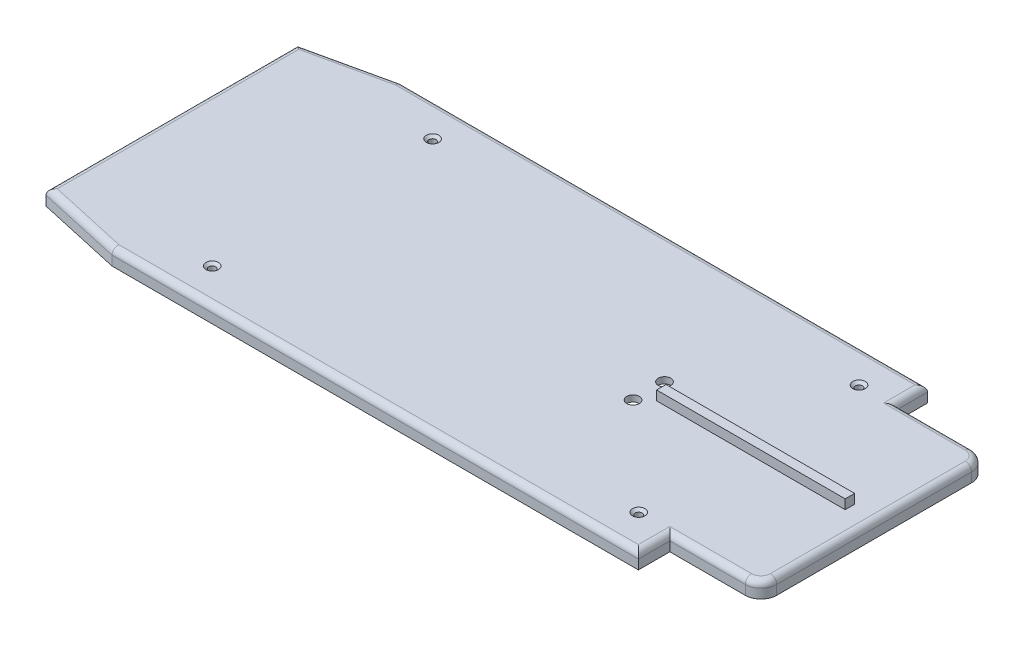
SolidWorks part; units mm, degrees
ref_plane "Front Plane" through (0, 0, 0) normal (0, 0, 1) x (1, 0, 0)
ref_plane "Top Plane" through (0, 0, 0) normal (0, 1, 0) x (1, 0, 0)
ref_plane "Right Plane" through (0, 0, 0) normal (1, 0, 0) x (0, 0, -1)
sketch "Sketch1" plane through (0, 0, 0) normal (0, 1, 0) x (1, 0, 0)
  line L0 (-95.25, 53.594) -> (95.25, -53.594) construction
  line L1 (-95.25, 53.594) -> (95.25, 53.594)
  line L2 (-95.25, 53.594) -> (-95.25, -53.594)
  line L3 (-95.25, -53.594) -> (95.25, -53.594)
  line L4 (95.25, 53.594) -> (95.25, -53.594)
  dimension "D1" = 190.5
  dimension "D2" = 107.188
extrude "Boss-Extrude1" add sketch "Sketch1" along normal blind 2.54
sketch "Sketch3" plane through (0, 0, 0) normal (0, -1, 0) x (1, 0, 0)
  line L0 (-95.25, 49.9745) -> (95.25, 49.9745) construction
  line L1 (-95.25, -53.594) -> (-95.25, 53.594) construction
  line L2 (95.25, 53.594) -> (95.25, -53.594) construction
  line L3 (-95.25, 53.594) -> (95.25, 53.594) construction
  line L4 (-91.6305, 53.594) -> (-91.6305, -53.594) construction
  line L5 (95.25, -53.594) -> (-95.25, -53.594) construction
  line L6 (-95.25, -49.9745) -> (95.25, -49.9745) construction
  line L7 (91.6305, 53.594) -> (91.6305, -53.594) construction
  circle A0 centre (-86.1695, -44.5135) radius 3.81
  circle A1 centre (-86.1695, 44.5135) radius 3.81
  circle A2 centre (86.1695, 44.5135) radius 3.81
  circle A3 centre (86.1695, -44.5135) radius 3.81
  dimension "D5" = 7.62
  dimension "D9" = 5.461
  dimension "D1" = 3.6195
  dimension "D2" = 3.6195
  dimension "D3" = 3.6195
  dimension "D4" = 3.6195
  dimension "D6" = 5.461
  dimension "D7" = 5.461
  dimension "D8" = 5.461
  dimension "D10" = 5.461
  dimension "D11" = 5.461
  dimension "D12" = 5.461
  dimension "D13" = 5.461
extrude "Boss-Extrude2" add sketch "Sketch3" along normal blind 3.81
sketch "Sketch4" plane through (0, 0, 53.594) normal (0, 0, 1) x (1, 0, 0)
  line L0 (-95.25, 0) -> (-95.25, 2.54)
  line L1 (-95.25, 2.54) -> (95.25, 2.54)
  line L2 (95.25, 2.54) -> (95.25, 0)
  line L3 (95.25, 2.54) -> (95.25, 0) construction
  line L4 (-95.25, 0) -> (95.25, 0) construction
  line L5 (95.25, 0) -> (-95.25, 0)
extrude "Boss-Extrude3" add sketch "Sketch4" along normal blind 4.826
sketch "Sketch5" plane through (0, 0, -53.594) normal (0, 0, -1) x (-1, 0, 0)
  line L0 (-95.25, 2.54) -> (-95.25, 0)
  line L1 (-95.25, 0) -> (95.25, 0)
  line L2 (95.25, 0) -> (95.25, 2.54)
  line L3 (95.25, 2.54) -> (-95.25, 2.54)
extrude "Boss-Extrude4" add sketch "Sketch5" along normal blind 4.826
sketch "Sketch6" plane through (95.25, 0, 0) normal (1, 0, 0) x (0, 0, -1)
  line L0 (-58.42, 2.54) -> (-58.42, 0)
  line L1 (-58.42, 0) -> (58.42, 0)
  line L2 (58.42, 0) -> (58.42, 2.54)
  line L3 (58.42, 2.54) -> (-58.42, 2.54)
extrude "Boss-Extrude5" add sketch "Sketch6" along normal blind 4.699
sketch "Sketch7" plane through (99.949, 0, 0) normal (1, 0, 0) x (0, 0, -1)
  line L0 (-45.72, 2.54) -> (-45.72, 0)
  line L1 (58.42, 2.54) -> (-58.42, 2.54) construction
  line L2 (-58.42, 0) -> (58.42, 0) construction
  line L3 (-45.72, 0) -> (45.72, 0)
  line L4 (45.72, 0) -> (45.72, 2.54)
  line L5 (45.72, 2.54) -> (-45.72, 2.54)
  line L6 (-58.42, 2.54) -> (-58.42, 0) construction
  line L7 (58.42, 0) -> (58.42, 2.54) construction
  dimension "D1" = 12.7
  dimension "D2" = 12.7
extrude "Boss-Extrude6" add sketch "Sketch7" along normal blind 36.83
sketch "Sketch8" plane through (0, 2.54, 0) normal (0, 1, 0) x (1, 0, 0)
  line L0 (-95.25, 58.42) -> (-112.776, 58.42)
  line L1 (-95.25, -58.42) -> (-112.776, -58.42)
  line L2 (-112.776, -58.42) -> (-147.066, -50.8)
  line L3 (-95.25, 58.42) -> (-95.25, -58.42)
  line L4 (-147.066, -50.8) -> (-147.066, 50.8)
  line L5 (-112.776, 58.42) -> (-147.066, 50.8)
  dimension "D1" = 7.62
  dimension "D2" = 7.62
  dimension "D3" = 34.29
  dimension "D4" = 34.29
  dimension "D5" = 17.526
extrude "Boss-Extrude7" add sketch "Sketch8" against normal blind 2.54
fillet "Fillet1" radius 6.35 2 edges at (136.779, 1.27, -45.72) (136.779, 1.27, 45.72)
sketch "Sketch9" plane through (0, -3.81, 0) normal (0, -1, 0) x (-1, 0, 0)
  circle A0 centre (-86.1695, -44.5135) radius 0.7
  circle A1 centre (-86.1695, 44.5135) radius 0.5848
  circle A2 centre (86.1695, 44.5135) radius 0.7489
  circle A3 centre (86.1695, -44.5135) radius 0.4954
extrude "Cut-Extrude1" cut sketch "Sketch9" against normal blind 17.78
hole_wizard "CSK for #3 Flat Head Machine Screw (100)1" positions "Sketch12" profile "Sketch10" countersink size "#3" standard "ANSI Inch"
sketch "Sketch12" plane through (0, 2.54, 0) normal (0, 1, 0) x (1, 0, 0)
  point P0 (86.1695, 44.5135)
  point P3 (86.1695, -44.5135)
  point P6 (-86.1695, 44.5135)
  point P9 (-86.1695, -44.5135)
sketch "Sketch10" plane through (86.1695, 2.54, -44.5135) normal (1, 0, 0) x (0, 0, 1)
  line L0 (0, 0) -> (0, 6.35)
  line L1 (0, 6.35) -> (1.397, 6.35)
  line L2 (1.397, 6.35) -> (1.397, 0.9484)
  line L3 (1.397, 0.9484) -> (2.5273, 0)
  line L5 (2.5273, 0) -> (0, 0)
  line L6 (-1.397, 0.9484) -> (-2.5273, 0) construction
  line L11 (0, -6.35) -> (0, 107.95) construction
  dimension "Thru Hole Dia." = 2.794
  dimension "Thru Hole Depth" = 6.35
  dimension "Near C'Sink Dia." = 5.0546
  dimension "Near C'Sink Angle" = 100
ref_plane "Plane1" through (-25.4, 0, 0) normal (1, 0, 0) x (0, 0, -1)
sketch "Sketch15" plane through (-25.4, 0, 0) normal (1, 0, 0) x (0, 0, -1)
  line L0 (0, 0) -> (0, 97.79) construction
  circle A0 centre (0, 97.79) radius 95.25
  circle A1 centre (0, 97.79) radius 97.79
  dimension "D2" = 190.5
  dimension "D1" = 97.79
extrude "Boss-Extrude8" add sketch "Sketch15" along normal blind 19.05
ref_plane "Plane2" through (127, 0, 0) normal (1, 0, 0) x (0, 0, -1)
sketch "Sketch16" plane through (127, 0, 0) normal (1, 0, 0) x (0, 0, -1)
  line L0 (0, 0) -> (0, 97.79) construction
  dimension "D1" = 97.79
sketch "Sketch21" plane through (-6.35, 0, 0) normal (1, 0, 0) x (0, 0, -1)
  circle A0 centre (0, 97.79) radius 97.79
sketch "Sketch22" plane through (127, 0, 0) normal (1, 0, 0) x (0, 0, -1)
  circle A0 centre (0, 97.79) radius 32.5967
loft "Loft1" add profiles "Sketch22", "Sketch21"
sketch "Sketch23" plane through (127, 0, 0) normal (1, 0, 0) x (0, 0, -1)
  circle A0 centre (0, 97.79) radius 31.75
sketch "Sketch24" plane through (-6.35, 0, 0) normal (-1, 0, 0) x (0, 0, 1)
  circle A0 centre (0, 97.79) radius 95.25
loft "Cut-Loft1" cut profiles "Sketch24", "Sketch23"
sketch "Sketch25" plane through (127, 0, 0) normal (1, 0, 0) x (0, 0, -1)
  line L0 (0, 65.1933) -> (0, 0)
  circle A0 centre (0, 97.79) radius 32.5967 construction
rib "Rib1" sketch "Sketch25" sketch "Sketch25" thickness 12.7 extrusion direction normal to sketch draft on no parameters "D1"=12.7
ref_plane "Plane3" through (12.7, 0, 0) normal (1, 0, 0) x (0, 0, -1)
sketch "Sketch26" plane through (12.7, 0, 0) normal (1, 0, 0) x (0, 0, -1)
  line L0 (0, 97.79) -> (0, 0) construction
  circle A1 centre (0, 97.79) radius 19.685
ref_plane "Plane4" through (45.72, 0, 0) normal (1, 0, 0) x (0, 0, -1)
sketch "Sketch27" plane through (45.72, 0, 0) normal (1, 0, 0) x (0, 0, -1)
  line L0 (0, 0) -> (0, 97.79) construction
  circle A0 centre (0, 97.79) radius 19.685
  dimension "D1" = 97.79
loft "Loft2" add profiles "Sketch26", "Sketch27"
sketch "Sketch28" plane through (12.7, 0, 0) normal (-1, 0, 0) x (0, 0, 1)
  circle A0 centre (0, 97.79) radius 18.415
extrude "Cut-Extrude2" cut sketch "Sketch28" against normal through all
sketch "Sketch29" plane through (45.72, 0, 0) normal (1, 0, 0) x (0, 0, -1)
  circle A0 centre (0, 97.79) radius 19.685
extrude "Boss-Extrude10" add sketch "Sketch29" along normal blind 2.54
sketch "Sketch30" plane through (48.26, 0, 0) normal (1, 0, 0) x (0, 0, -1)
  circle A0 centre (0, 97.79) radius 5.08
extrude "Cut-Extrude3" cut sketch "Sketch30" against normal blind 2.54
sketch "Sketch31" plane through (48.26, 0, 0) normal (1, 0, 0) x (0, 0, -1)
  line L0 (0, 102.87) -> (-19.0182, 102.87)
  line L1 (0, 102.87) -> (19.0182, 102.87)
  line L2 (0, 92.71) -> (19.0182, 92.71)
  line L3 (0, 0) -> (0, 97.79) construction
  line L4 (0, 92.71) -> (-19.0182, 92.71)
  circle A0 centre (0, 97.79) radius 5.08 construction
  circle A1 centre (0, 97.79) radius 19.685 construction
  arc A2 (-19.0182, 102.87) -> (-19.0182, 92.71) centre (0, 97.79) ccw
  arc A3 (19.0182, 102.87) -> (19.0182, 92.71) centre (0, 97.79) cw
extrude "Cut-Extrude4" cut sketch "Sketch31" against normal blind 2.54
sketch "Sketch33" plane through (12.7, 0, 0) normal (-1, 0, 0) x (0, 0, 1)
  line L0 (0, 97.79) -> (0, 0) construction
  line L1 (0, 85.2478) -> (-2.54, 85.2478)
  line L2 (-2.54, 85.2478) -> (-2.54, 0)
  line L3 (-2.54, 0) -> (2.54, 0)
  line L4 (2.54, 0) -> (2.54, 85.2478)
  line L5 (2.54, 85.2478) -> (0, 85.2478)
  dimension "D1" = 2.54
  dimension "D2" = 2.54
extrude "Boss-Extrude11" add sketch "Sketch33" against normal blind 35.56
sketch "Sketch34" plane through (12.7, 0, 0) normal (-1, 0, 0) x (0, 0, 1)
  circle A0 centre (0, 97.79) radius 18.415
extrude "Cut-Extrude5" cut sketch "Sketch34" against normal blind 33.02
sketch "Sketch35" plane through (45.72, 0, 0) normal (1, 0, 0) x (0, 0, -1)
  line L0 (0, 97.79) -> (104.143, 97.79) construction
  line L1 (0, 97.79) -> (-120.52, 97.79) construction
pattern_circular "CirPattern1" count 4 over 360 about axis through (0, 97.79, 0) along (1, 0, 0) of "Boss-Extrude11"
sketch "Sketch37" plane through (-25.4, 0, 0) normal (1, 0, 0) x (0, 0, -1)
  circle A0 centre (0, 97.79) radius 18.415
extrude "Cut-Extrude6" cut sketch "Sketch37" along normal blind 71.12
sketch "Sketch38" plane through (48.26, 0, 0) normal (1, 0, 0) x (0, 0, -1)
  line L0 (-19.0182, 102.87) -> (19.0182, 102.87)
  line L1 (-19.0182, 92.71) -> (19.0182, 92.71)
  arc A0 (-19.0182, 92.71) -> (-19.0182, 102.87) centre (0.2838, 97.79) cw
  arc A1 (19.0182, 102.87) -> (19.0182, 92.71) centre (-3.1186, 97.79) cw
extrude "Cut-Extrude7" cut sketch "Sketch38" against normal blind 2.54
sketch "Sketch39" plane through (48.26, 0, 0) normal (1, 0, 0) x (0, 0, -1)
  circle A0 centre (0, 97.721) radius 19.616
  circle A1 centre (0, 97.721) radius 18.4605
extrude "Boss-Extrude12" add sketch "Sketch39" against normal blind 2.54
sketch "Sketch41" plane through (0, 100.33, 0) normal (0, 1, 0) x (1, 0, 0)
  line L0 (12.7, 88.4402) -> (48.26, 71.0464)
  line L1 (48.26, 71.0464) -> (48.26, 97.79)
  line L2 (48.26, 97.79) -> (12.7, 97.79)
  line L3 (12.7, 97.79) -> (12.7, 88.4402)
  line L4 (12.7, -88.4402) -> (12.7, -97.79)
  line L5 (12.7, -97.79) -> (48.26, -97.79)
  line L6 (48.26, -97.79) -> (48.26, -71.0464)
  line L7 (48.26, -71.0464) -> (12.7, -88.4402)
extrude "Cut-Extrude8" cut sketch "Sketch41" against normal blind 5.08
sketch "Sketch42" plane through (0, 0, 2.54) normal (0, 0, 1) x (1, 0, 0)
  line L0 (12.7, 186.2302) -> (12.7, 195.58)
  line L1 (12.7, 195.58) -> (48.26, 195.58)
  line L2 (48.26, 195.58) -> (48.26, 168.8364)
  line L3 (48.26, 168.8364) -> (12.7, 186.2302)
extrude "Cut-Extrude9" cut sketch "Sketch42" against normal blind 5.08
sketch "Sketch43" plane through (0, 0, 0) normal (0, 1, 0) x (1, 0, 0)
  line L0 (0, 0) -> (118.8184, 0) construction
  circle A0 centre (45.72, -6.35) radius 2.54
  circle A1 centre (45.72, 6.35) radius 2.54
  dimension "D1" = 5.08
  dimension "D2" = 5.08
  dimension "D3" = 6.35
  dimension "D4" = 6.35
  dimension "D5" = 45.72
extrude "Cut-Extrude10" cut sketch "Sketch43" along normal blind 58.42
fillet "Fillet2" radius 2.54 12 edges at (134.9191, 2.54, 43.8601) (134.9191, 2.54, -43.8601) (136.779, 2.54, 0) (-6.4135, 2.54, 58.42) (-129.921, 2.54, 54.61) (-147.066, 2.54, 0) (-6.4135, 2.54, -58.42) (-129.921, 2.54, -54.61)
ref_plane "Plane5" through (139.7, 0, 0) normal (1, 0, 0) x (0, 0, -1)
sketch "Sketch46" plane through (0, -3.81, 0) normal (0, -1, 0) x (-1, 0, 0)
  line L1 (151.9645, -58.42) -> (-142.8882, -58.42)
  line L2 (151.9645, -58.42) -> (151.9645, 59.3152)
  line L3 (151.9645, 59.3152) -> (-142.8882, 59.3152)
  line L4 (-142.8882, -58.42) -> (-142.8882, 59.3152)
sketch "Sketch47" plane through (0, 2.54, 0) normal (0, 1, 0) x (1, 0, 0)
  line L1 (-61.8482, 104.9229) -> (129.311, 104.9229)
  line L2 (-61.8482, 104.9229) -> (-61.8482, -104.7114)
  line L3 (-61.8482, -104.7114) -> (129.311, -104.7114)
  line L4 (129.311, 104.9229) -> (129.311, -104.7114)
extrude "Cut-Extrude14" cut sketch "Sketch47" along normal blind 200.66
sketch "Sketch48" plane through (127, 0, 0) normal (1, 0, 0) x (0, 0, -1)
  line L0 (-1.905, 2.54) -> (-1.905, 4.445)
  line L1 (-39.37, 2.54) -> (39.37, 2.54) construction
  line L4 (-1.905, 6.35) -> (1.905, 6.35)
  line L7 (1.905, 4.445) -> (1.905, 2.54)
  line L8 (1.905, 2.54) -> (-1.905, 2.54)
  line L9 (0, 0) -> (0, 97.79) construction
  line L10 (-1.905, 4.445) -> (-1.905, 6.35)
  line L11 (1.905, 4.445) -> (1.905, 6.35)
  dimension "D1" = 1.905
  dimension "D2" = 1.905
  dimension "D7" = 3.81
extrude "Boss-Extrude13" add sketch "Sketch48" against normal blind 76.2
sketch "Sketch49" plane through (0, 0, 0) normal (0, -1, 0) x (-1, 0, 0)
  line L0 (147.066, -50.8) -> (112.776, -58.42)
  line L1 (112.776, -58.42) -> (-99.949, -58.42)
  line L2 (-99.949, -58.42) -> (-99.949, -45.72)
  line L3 (-99.949, -45.72) -> (-130.429, -45.72)
  line L4 (-136.779, -39.37) -> (-136.779, 39.37)
  line L5 (-130.429, 45.72) -> (-99.949, 45.72)
  line L6 (-99.949, 45.72) -> (-99.949, 58.42)
  line L7 (-99.949, 58.42) -> (112.776, 58.42)
  line L8 (112.776, 58.42) -> (147.066, 50.8)
  line L9 (147.066, 50.8) -> (147.066, -50.8)
  line L10 (-134.239, -39.37) -> (-134.239, 39.37)
  line L11 (-130.429, 43.18) -> (-97.409, 43.18)
  line L12 (-97.409, 43.18) -> (-97.409, 55.88)
  line L13 (-97.409, 55.88) -> (112.4972, 55.88)
  line L14 (112.4972, 55.88) -> (144.526, 48.7625)
  line L15 (144.526, 48.7625) -> (144.526, -48.7625)
  line L16 (144.526, -48.7625) -> (112.4972, -55.88)
  line L17 (112.4972, -55.88) -> (-97.409, -55.88)
  line L18 (-97.409, -55.88) -> (-97.409, -43.18)
  line L19 (-97.409, -43.18) -> (-130.429, -43.18)
  arc A0 (-130.429, -45.72) -> (-136.779, -39.37) centre (-130.429, -39.37) cw
  arc A1 (-130.429, 45.72) -> (-136.779, 39.37) centre (-130.429, 39.37) ccw
  arc A2 (-130.429, -43.18) -> (-134.239, -39.37) centre (-130.429, -39.37) cw
  arc A3 (-130.429, 43.18) -> (-134.239, 39.37) centre (-130.429, 39.37) ccw
  dimension "D1" = 6.35
  dimension "D2" = 6.35
  dimension "D3" = 2.54
extrude "Boss-Extrude14" add sketch "Sketch49" along normal blind 3.81
sketch "Sketch50" plane through (0, -3.81, 0) normal (0, -1, 0) x (-1, 0, 0)
  circle A0 centre (86.1695, -44.5135) radius 3.81
  circle A1 centre (86.1695, -44.5135) radius 1.397
  circle A2 centre (-86.1695, -44.5135) radius 3.81
  circle A3 centre (-86.1695, -44.5135) radius 1.397
  circle A4 centre (-86.1695, 44.5135) radius 3.81
  circle A5 centre (-86.1695, 44.5135) radius 1.397
  circle A6 centre (86.1695, 44.5135) radius 3.81
  circle A7 centre (86.1695, 44.5135) radius 1.397
extrude "Boss-Extrude15" add sketch "Sketch50" along normal blind 3.81
